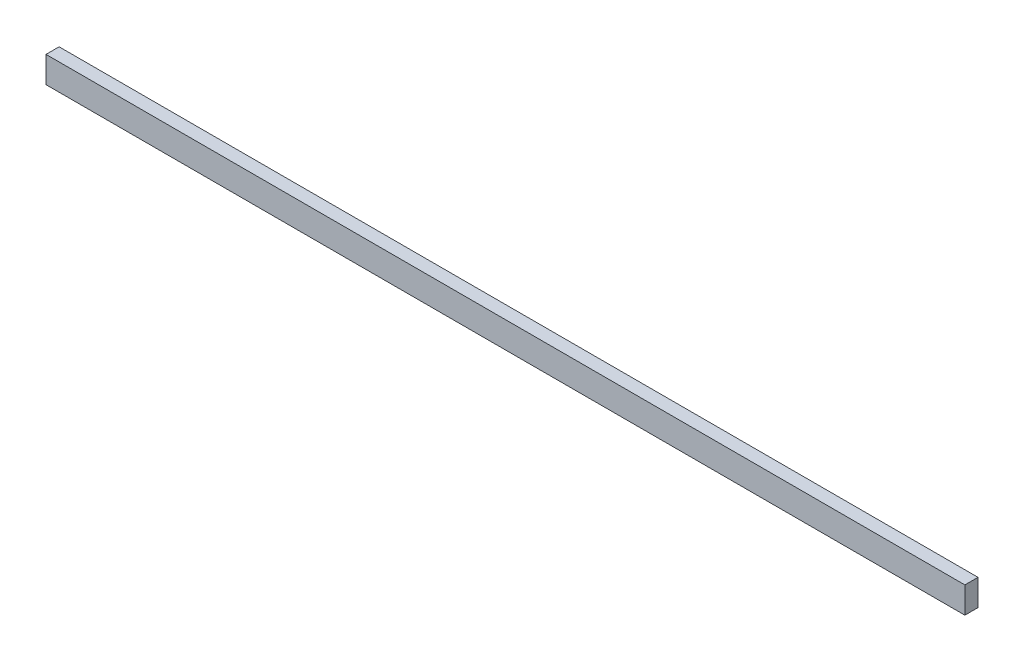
SolidWorks part; units mm, degrees
ref_plane "Face" through (0, 0, 0) normal (0, 0, 1) x (1, 0, 0)
ref_plane "Dessus" through (0, 0, 0) normal (0, 1, 0) x (1, 0, 0)
ref_plane "Droite" through (0, 0, 0) normal (1, 0, 0) x (0, 0, -1)
sketch "Esquisse1" plane through (0, 0, 0) normal (0, 0, 1) x (1, 0, 0)
  line L1 (0, 0) -> (350, 0)
  line L2 (0, 0) -> (0, 10)
  line L3 (0, 10) -> (350, 10)
  line L4 (350, 0) -> (350, 10)
  dimension "D1" = 350
  dimension "D2" = 10
extrude "Extrusion1" add sketch "Esquisse1" along normal blind 5
